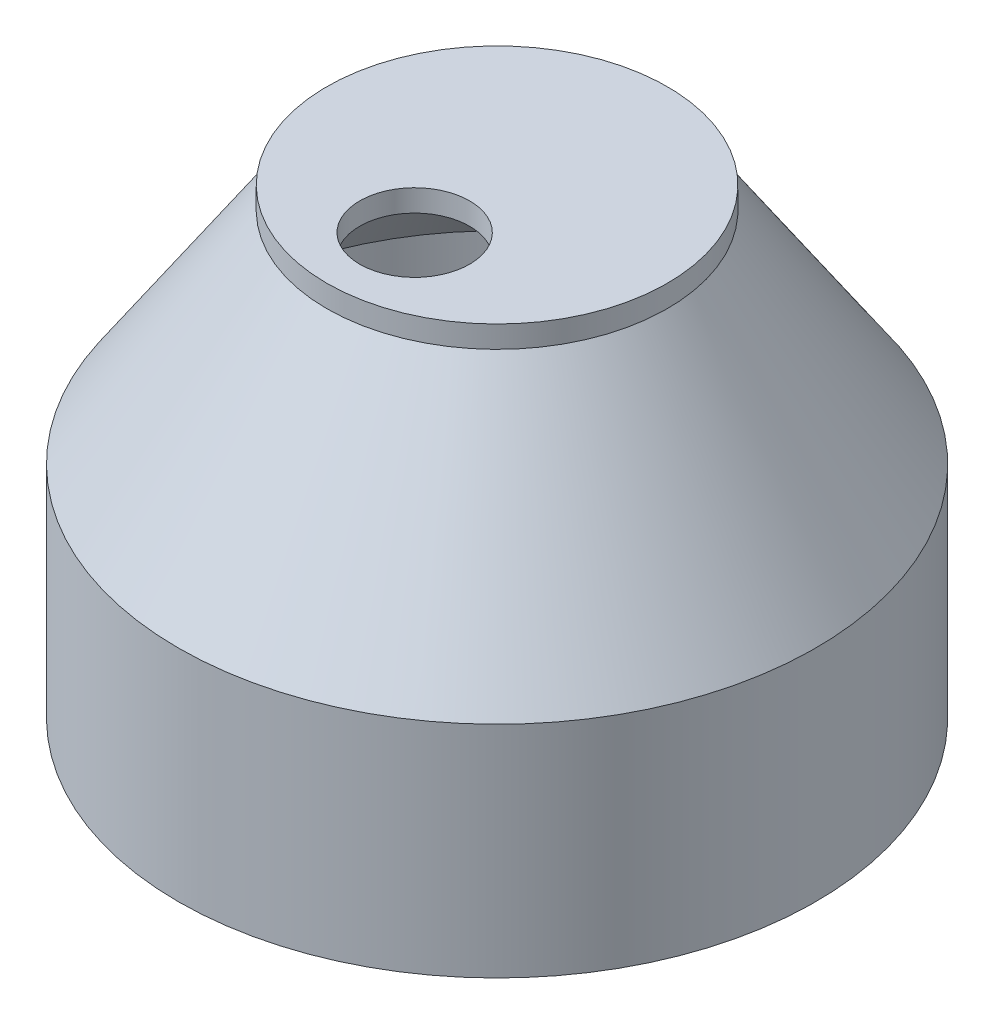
SolidWorks part; units mm, degrees
ref_plane "Ön Düzlem" through (0, 0, 0) normal (0, 0, 1) x (1, 0, 0)
ref_plane "Üst Düzlem" through (0, 0, 0) normal (0, 1, 0) x (1, 0, 0)
ref_plane "Sağ Düzlem" through (0, 0, 0) normal (1, 0, 0) x (0, 0, -1)
sketch "Çizim5" plane through (0, 0, 0) normal (1, 0, 0) x (0, 0, -1)
  line L0 (12.5, 20) -> (15.5, 20)
  line L1 (15.5, 20) -> (29, 0)
  line L2 (29, 0) -> (29, -20)
  line L3 (29, -20) -> (26, -20)
  line L4 (26, -20) -> (26, 0)
  line L5 (26, 0) -> (12.5, 20)
  line L6 (0, 40.2843) -> (0, -47.2424) construction
  dimension "D1" = 20
  dimension "D2" = 20
  dimension "D3" = 20
  dimension "D4" = 3
  dimension "D5" = 26
  dimension "D6" = 12.5
revolve "Döndür1" add sketch "Çizim5" angle 360 about L6
sketch "Çizim6" plane through (0, 20, 0) normal (0, 1, 0) x (1, 0, 0)
  circle A0 centre (0, 0) radius 15.5
  circle A1 centre (0, -7.5) radius 5
  circle A2 centre (0, 0) radius 12.5 construction
  point P5 (0, 0)
  dimension "D1" = 10
extrude "Yükseklik-Ekstrüzyon2" add sketch "Çizim6" along normal blind 2
